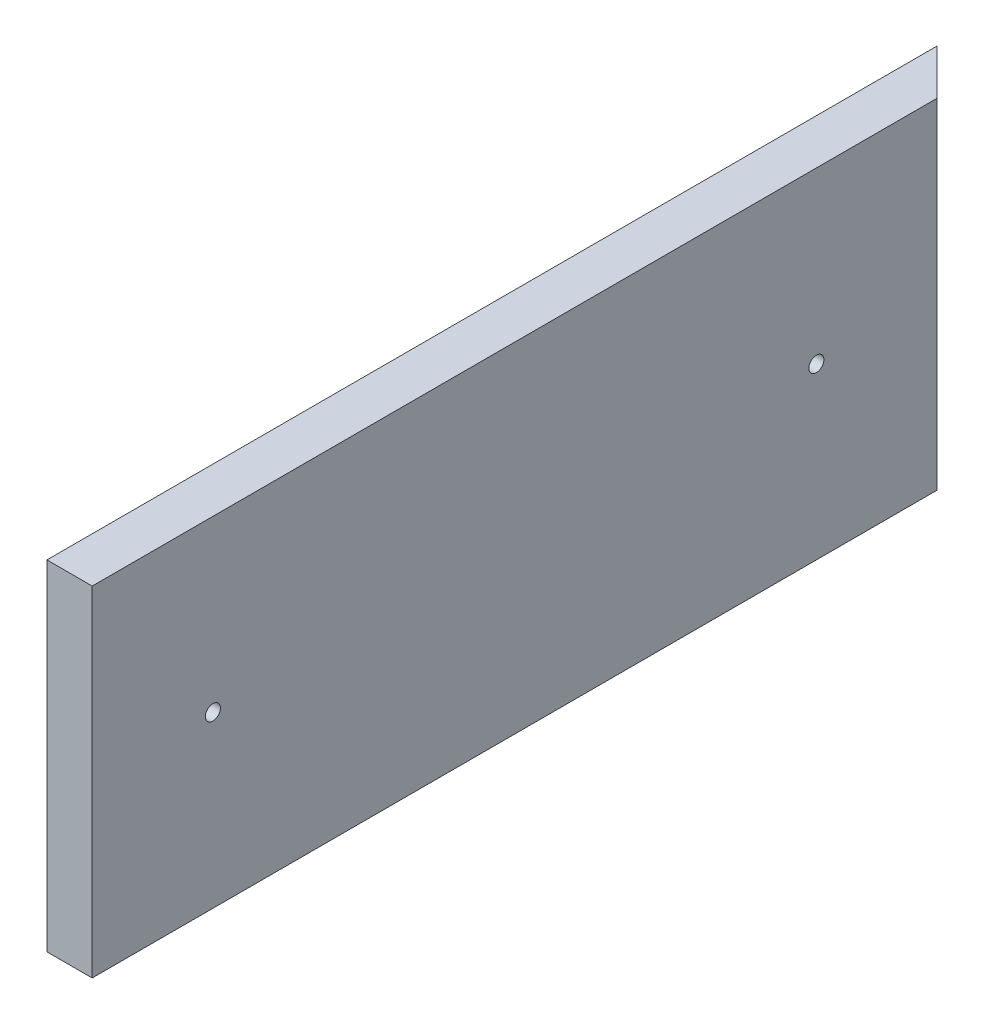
SolidWorks part; units mm, degrees
ref_plane "Front Plane" through (0, 0, 0) normal (0, 0, 1) x (1, 0, 0)
ref_plane "Top Plane" through (0, 0, 0) normal (0, 1, 0) x (1, 0, 0)
ref_plane "Right Plane" through (0, 0, 0) normal (1, 0, 0) x (0, 0, -1)
sketch "Sketch2" plane through (0, 0, 0) normal (0, 0, 1) x (1, 0, 0)
  line L1 (0, 0) -> (38.1, 0)
  line L2 (0, 0) -> (0, 285.75)
  line L3 (0, 285.75) -> (38.1, 285.75)
  line L4 (38.1, 0) -> (38.1, 285.75)
  line L5 (0, 0) -> (38.1, 285.75) construction
  line L6 (0, 285.75) -> (38.1, 0) construction
  point P4 (19.05, 142.875)
extrude "Boss-Extrude1" add sketch "Sketch2" along normal blind 711.2
sketch "Sketch3" plane through (0, 285.75, 0) normal (0, 1, 0) x (1, 0, 0)
  line L4 (38.1, 0) -> (0, 0)
  line L5 (0, 38.1) -> (38.1, 0)
  line L6 (0, 38.1) -> (0, 0)
  dimension "D1" = 45
extrude "Boss-Extrude2" add sketch "Sketch3" against normal up to surface (285.75 mm away)
sketch "Sketch4" plane through (38.1, 0, 0) normal (1, 0, 0) x (0, 0, -1)
  line L0 (-711.2, 142.875) -> (-609.6, 142.875) construction
  line L1 (-711.2, 0) -> (-711.2, 285.75) construction
  line L2 (-101.6, 142.875) -> (0, 142.875) construction
  line L3 (0, 0) -> (0, 285.75) construction
  circle A0 centre (-609.6, 142.875) radius 6.35
  circle A1 centre (-101.6, 142.875) radius 6.35
extrude "Cut-Extrude1" cut sketch "Sketch4" against normal through all
equation "\"system_width\"= 7ft + 10 "
equation "\"system_length\"= 95.5"
equation "\"module_board_length\"= 11.25in"
equation "\"module_board_width\"= 1.5in"
equation "\"module_width\"= (\"system_width\" -  2* \"module_trim_thickness\") / 2"
equation "\"module_length\"= (\"system_top_length\" - \"module_trim_thickness\")/ 2"
equation "\"module_board_long_depth\"= \"module_length\" - \"module_lip_width\""
equation "\"module_board_short_depth\"= \"module_width\" - ( 2 * \"module_board_width\" ) - \"module_lip_width\""
equation "\"module_board_hole\"= 0.5in"
equation "\"module_board_hole_position\"= ( ( \"module_width\" - \"module_board_hole_seperation\" ) / 2 ) + \"module_board_width\"/2"
equation "\"module_board_hole_seperation\"= 20in"
equation "\"module_top_length\"= \"module_length\" + \"module_lip_width\""
equation "\"module_top_width\"= \"module_width\" + \"module_lip_width\""
equation "\"module_top_thickness\"= 0.75in"
equation "\"module_lip_width\"= 1.5in"
equation "\"D1@Sketch2\"=\"module_lip_width\""
equation "\"D2@Sketch2\"=\"module_board_length\""
equation "\"D1@Boss-Extrude1\"=\"module_length\" - \"module_lip_width\""
equation "\"D1@Sketch4\"=\"module_board_hole_seperation\""
equation "\"D3@Sketch4\"=\"module_board_hole\""
equation "\"system_step_width\"= 3ft"
equation "\"system_top_length\"= \"system_length\" - \"system_step_length\""
equation "\"module_trim_thickness\"= 1in"
equation "\"module_trim_height\"= 14in"
equation "\"step_board_length\"= 5.5in"
equation "\"step_board_width\"= 1.5in"
equation "\"system_step_length\"= 2ft+11.5"
equation "\"module_top_overhang\"= 4.5in"
equation "\"module_trim_angle\"= 45deg"
equation "\"step_module_width\"= \"module_width\""
equation "\"step_module_length\"= \"system_step_length\" - \"module_trim_thickness\""
equation "\"step_board_short_depth\"= \"step_module_length\" - \"module_lip_width\""
equation "\"step_board_long_depth\"= \"step_module_width\" - (2 * \"module_board_width\") - \"module_lip_width\""
